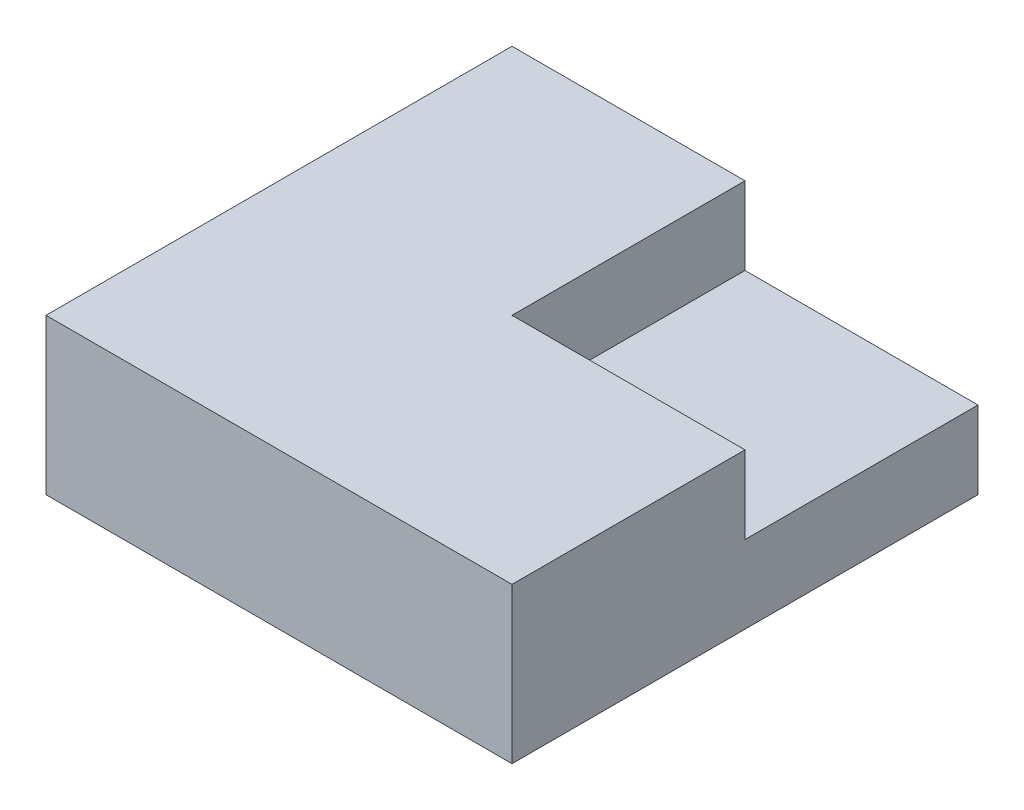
SolidWorks part; units mm, degrees
ref_plane "Plan de face" through (0, 0, 0) normal (0, 0, 1) x (1, 0, 0)
ref_plane "Plan de dessus" through (0, 0, 0) normal (0, 1, 0) x (1, 0, 0)
ref_plane "Plan de droite" through (0, 0, 0) normal (1, 0, 0) x (0, 0, -1)
sketch "Esquisse1" plane through (0, 0, 0) normal (0, 0, 1) x (1, 0, 0)
  line L1 (0, 0) -> (30, 0)
  line L2 (0, 0) -> (0, 10)
  line L3 (0, 10) -> (30, 10)
  line L4 (30, 0) -> (30, 10)
  dimension "D1" = 30
  dimension "D2" = 10
extrude "Extrusion1" add sketch "Esquisse1" along normal blind 30
sketch "Esquisse2" plane through (0, 10, 0) normal (0, 1, 0) x (1, 0, 0)
  line L1 (30, 0) -> (15, 0)
  line L2 (30, 0) -> (30, -15)
  line L3 (30, -15) -> (15, -15)
  line L4 (15, 0) -> (15, -15)
  dimension "D1" = 15
  dimension "D2" = 15
extrude "Enlèv. mat.-Extru.1" cut sketch "Esquisse2" against normal blind 5
